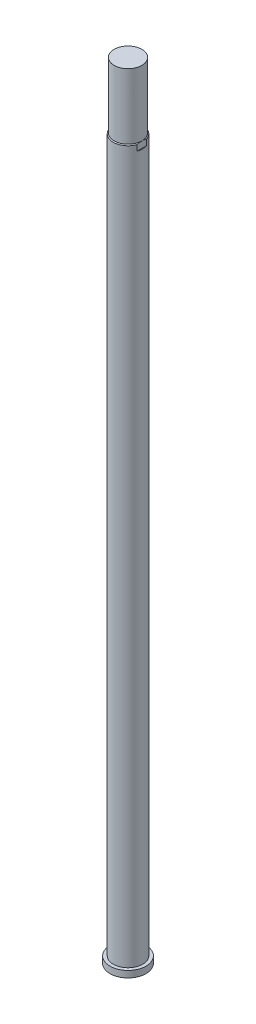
SolidWorks part; units mm, degrees
ref_plane "Plan de face" through (0, 0, 0) normal (0, 0, 1) x (1, 0, 0)
ref_plane "Plan de dessus" through (0, 0, 0) normal (0, 1, 0) x (1, 0, 0)
ref_plane "Plan de droite" through (0, 0, 0) normal (1, 0, 0) x (0, 0, -1)
sketch "Esquisse1" plane through (0, 0, 0) normal (0, 0, 1) x (1, 0, 0)
  line L0 (0, 212.3277) -> (0, -73.5531) construction
  line L1 (4.5, 173.7819) -> (4.5, -66.2181)
  line L2 (4.5, 173.7819) -> (0, 173.7819)
  line L3 (4.5, -66.2181) -> (0, -66.2181)
  line L4 (0, 173.7819) -> (0, -66.2181)
  dimension "D1" = 240
  dimension "D2" = 9
revolve "Révolution1" add sketch "Esquisse1" angle 360 about L0
sketch "Esquisse2" plane through (0, 173.7819, 0) normal (0, 1, 0) x (1, 0, 0)
  circle A0 centre (0, 0) radius 4.25
  circle A1 centre (0, 0) radius 4.5
  dimension "D1" = 8.5
  dimension "D2" = 9
extrude "Enlèv. mat.-Extru.1" cut sketch "Esquisse2" against normal blind 20
chamfer "Chanfrein1" distance 0.25 angle 45 1 edges at (0, 153.7819, 4.5)
sketch "Esquisse3" plane through (0, 173.7819, 0) normal (0, 1, 0) x (1, 0, 0)
  line L1 (4.25, 3.008) -> (5.69, 3.008)
  line L2 (4.25, 3.008) -> (4.25, -2.96)
  line L3 (4.25, -2.96) -> (5.69, -2.96)
  line L4 (5.69, 3.008) -> (5.69, -2.96)
  line L5 (-4.25, 3.008) -> (-5.626, 3.008)
  line L6 (-4.25, 3.008) -> (-4.25, -3.136)
  line L7 (-4.25, -3.136) -> (-5.626, -3.136)
  line L8 (-5.626, 3.008) -> (-5.626, -3.136)
  dimension "D1" = 4.25
  dimension "D2" = 4.25
extrude "Enlèv. mat.-Extru.2" cut sketch "Esquisse3" against normal blind 22
sketch "Esquisse4" plane through (0, -66.2181, 0) normal (0, -1, 0) x (1, 0, 0)
  circle A0 centre (0, 0) radius 5.5
  dimension "D1" = 11
extrude "Extrusion1" add sketch "Esquisse4" against normal blind 2
